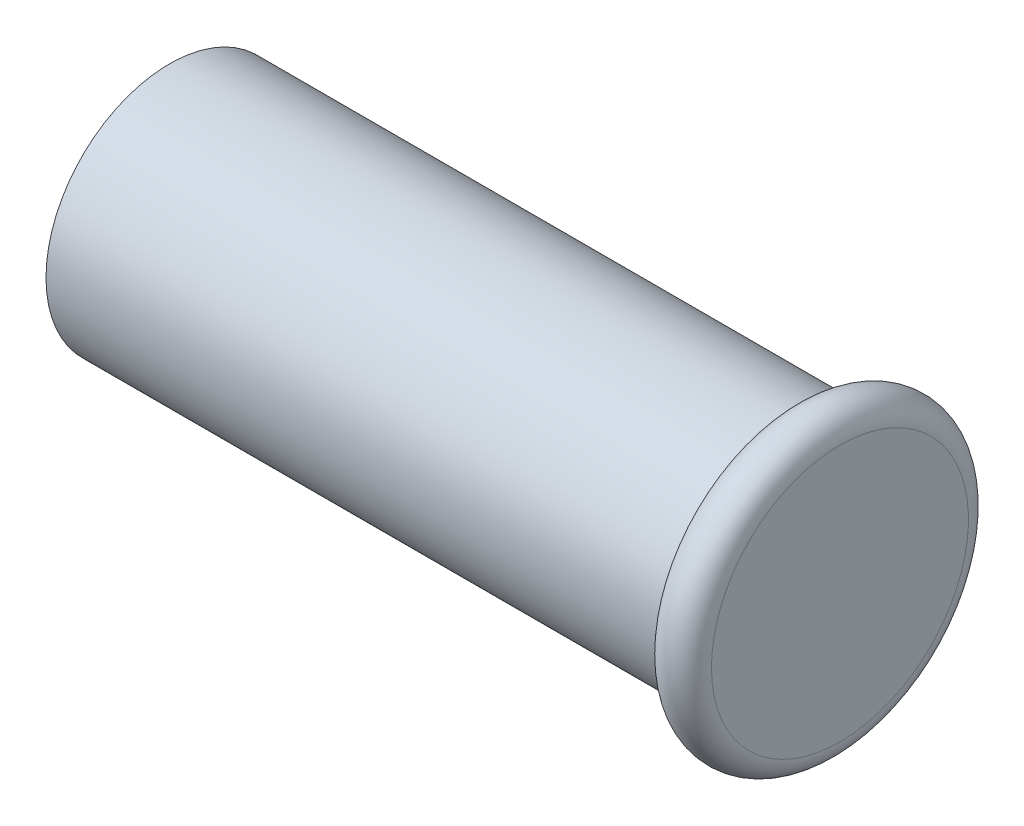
SolidWorks part; units mm, degrees
ref_plane "Front Plane" through (0, 0, 0) normal (0, 0, 1) x (1, 0, 0)
ref_plane "Top Plane" through (0, 0, 0) normal (0, 1, 0) x (1, 0, 0)
ref_plane "Right Plane" through (0, 0, 0) normal (1, 0, 0) x (0, 0, -1)
sketch "Sketch1" plane through (0, 0, 0) normal (0, 0, 1) x (1, 0, 0)
  line L0 (-8.9377, 0) -> (3.3356, 0) construction
  line L1 (0, 0) -> (0, 2.9845)
  line L2 (-1.0922, 2.9845) -> (-1.0922, 2.8702)
  line L3 (-1.0922, 2.8702) -> (-15.5702, 2.8702)
  line L4 (-15.5702, 2.8702) -> (-15.5702, 2.54)
  line L5 (-15.5702, 2.54) -> (-1.27, 2.54)
  line L6 (-1.27, 2.54) -> (-1.27, 0)
  line L7 (-1.27, 0) -> (0, 0)
  line L8 (-1.8117, 3.5306) -> (1.0044, 3.5306) construction
  arc A0 (0, 2.9845) -> (-1.0922, 2.9845) centre (-0.5461, 2.9845) ccw
  dimension "D1" = 1.0922
  dimension "D2" = 3.5306
  dimension "D3" = 5.7404
  dimension "D4" = 5.08
  dimension "D5" = 1.27
  dimension "D6" = 15.5702
revolve "Revolve1" add sketch "Sketch1" angle 360 about L0
